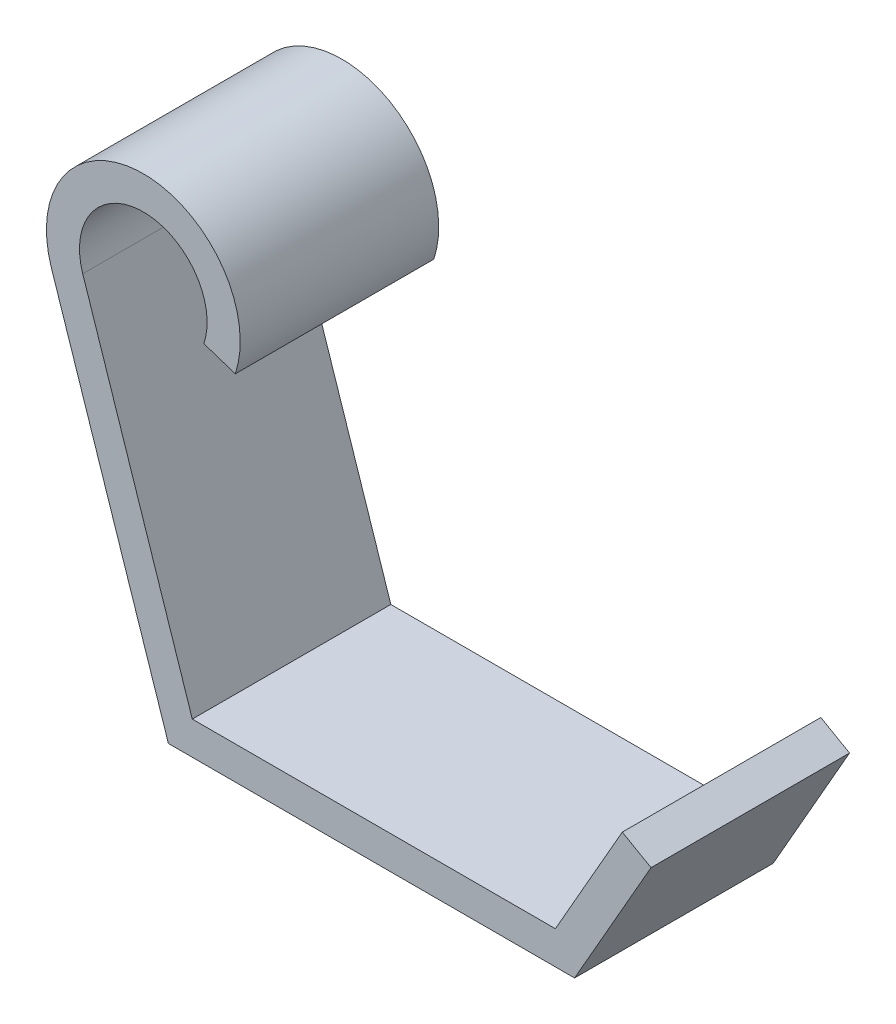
SolidWorks part; units mm, degrees
ref_plane "Front Plane" through (0, 0, 0) normal (0, 0, 1) x (1, 0, 0)
ref_plane "Top Plane" through (0, 0, 0) normal (0, 1, 0) x (1, 0, 0)
ref_plane "Right Plane" through (0, 0, 0) normal (1, 0, 0) x (0, 0, -1)
sketch "Sketch1" plane through (0, 0, 0) normal (0, 0, 1) x (1, 0, 0)
  line L0 (72.9294, 20.2181) -> (61.3763, 0)
  line L1 (61.3763, 0) -> (0, 0)
  line L2 (0, 0) -> (-17.6908, 53.4334)
  arc A0 (-17.6908, 53.4334) -> (10.109, 53.4334) centre (-3.7909, 58.0354) cw
extrude "Extrude-Thin2" add sketch "Sketch1" along normal blind 30 thin
